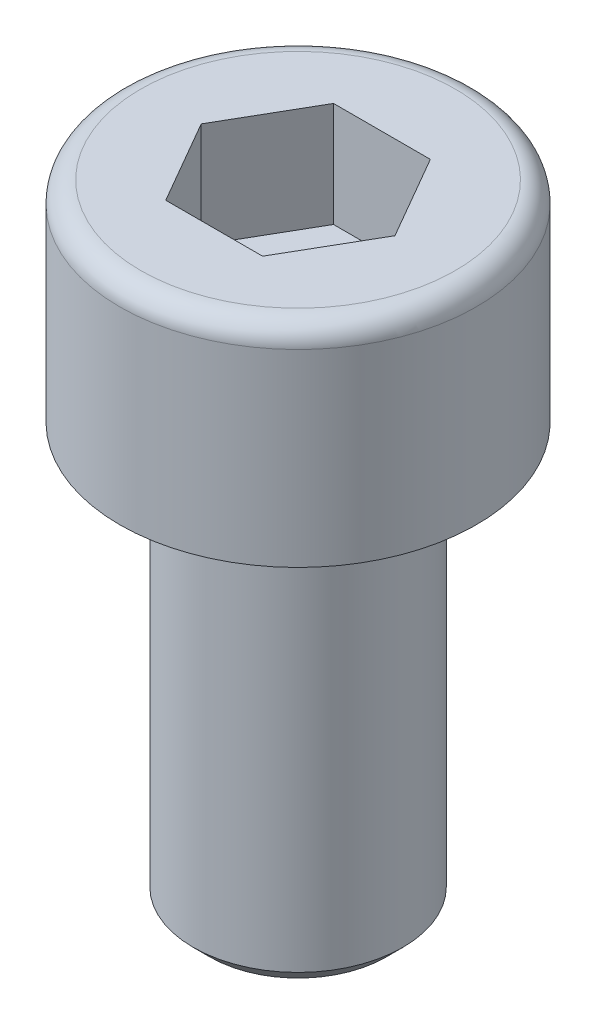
SolidWorks part; units mm, degrees
ref_plane "Plan1" through (0, 0, 0) normal (0, 0, 1) x (1, 0, 0)
ref_plane "Plan2" through (0, 0, 0) normal (0, 1, 0) x (1, 0, 0)
ref_plane "Plan3" through (0, 0, 0) normal (1, 0, 0) x (0, 0, -1)
sketch "Esquisse1" plane through (0, 0, 0) normal (0, 0, 1) x (1, 0, 0)
  line L0 (0, 17.6578) -> (0, -4.1627) construction
  line L1 (0, 15) -> (-3.75, 15)
  line L3 (-4.25, 14.5) -> (-4.25, 10)
  line L4 (-4.25, 10) -> (-2.5, 10)
  line L7 (-2.5, 10) -> (-2.5, 0)
  line L12 (-2.5, 0) -> (0, 0)
  line L13 (0, 15) -> (0, 0)
  arc A0 (-4.25, 14.5) -> (-3.75, 15) centre (-3.75, 14.5) cw
  dimension "D1" = 0.5
  dimension "D2" = 8.5
  dimension "D3" = 10
  dimension "D4" = 5
  dimension "D5" = 5
revolve "Base-Révolution" add sketch "Esquisse1" angle 360 about L0
sketch "Esquisse2" plane through (0, 15, 0) normal (0, 1, 0) x (-1, 0, 0)
  line L0 (2.3094, 0) -> (-2.3094, 0) construction
  line L1 (1.1547, 2) -> (-1.1547, -2) construction
  line L2 (1.1547, -2) -> (-1.1547, 2) construction
  line L3 (-1.1547, -2) -> (1.1547, -2)
  line L4 (1.1547, -2) -> (2.3094, 0)
  line L5 (2.3094, 0) -> (1.1547, 2)
  line L6 (1.1547, 2) -> (-1.1547, 2)
  line L7 (-1.1547, 2) -> (-2.3094, 0)
  line L8 (-2.3094, 0) -> (-1.1547, -2)
  dimension "D1" = 4
extrude "Enlèv. mat.-Extru.1" cut sketch "Esquisse2" against normal blind 2.5
chamfer "Chanfrein1" distance 0.4 angle 45
